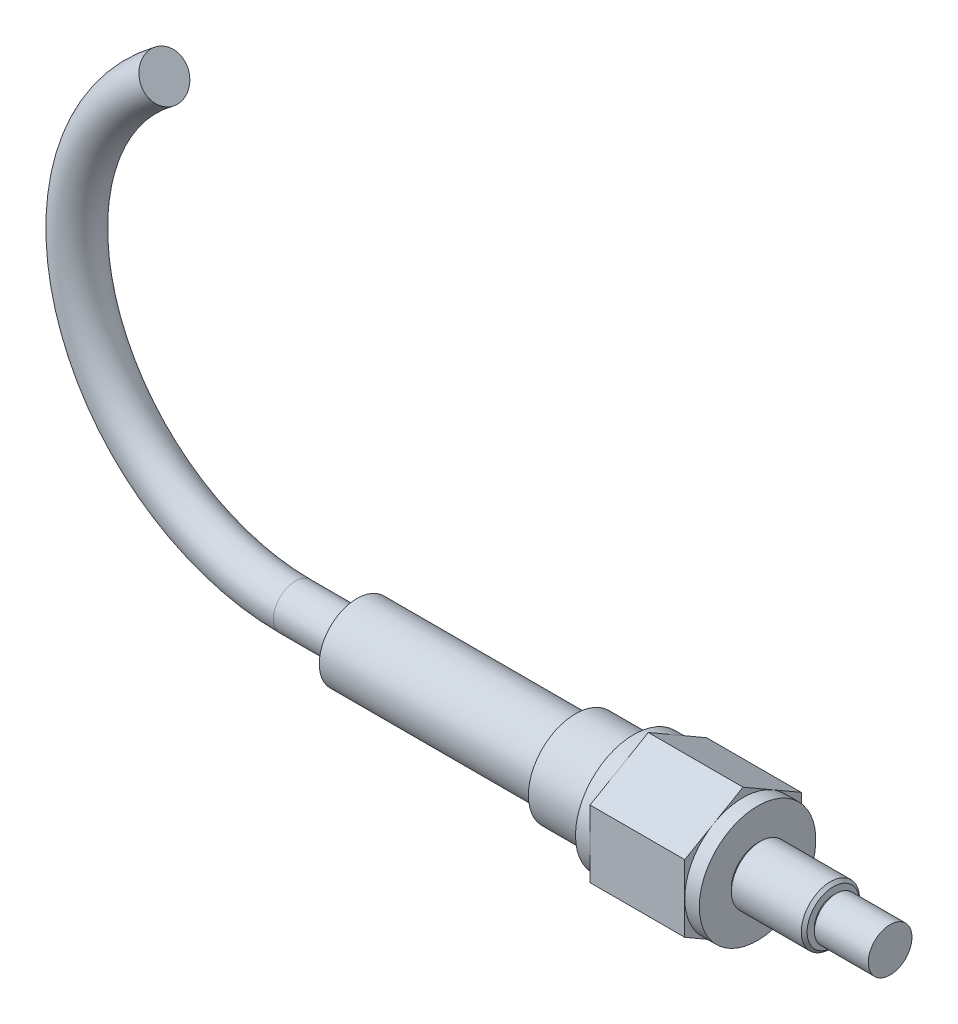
SolidWorks part; units mm, degrees
ref_plane "Front Plane" through (0, 0, 0) normal (0, 0, 1) x (1, 0, 0)
ref_plane "Top Plane" through (0, 0, 0) normal (0, 1, 0) x (1, 0, 0)
ref_plane "Right Plane" through (0, 0, 0) normal (1, 0, 0) x (0, 0, -1)
sketch "Sketch1" plane through (0, 0, 0) normal (0, 0, 1) x (1, 0, 0)
  line L0 (0, 0) -> (21.5625, 0) construction
  line L1 (0, 0) -> (0, 1.5)
  line L2 (0, 1.5) -> (-3.7, 1.5)
  line L3 (-3.7, 1.5) -> (-3.7, 1.3)
  line L4 (-3.7, 1.3) -> (-3.9, 1.3)
  line L5 (-3.9, 1.3) -> (-3.9, 1.8)
  line L6 (-3.9, 1.8) -> (-4.1, 2)
  line L7 (-4.1, 2) -> (-8.9, 2)
  line L8 (-8.9, 2) -> (-9.1, 1.8)
  line L9 (-9.1, 1.8) -> (-9.1, 4)
  line L10 (-9.1, 4) -> (-10.1, 4)
  line L11 (-10.1, 4) -> (-10.1, 0)
  line L12 (-10.1, 0) -> (0, 0)
  line L13 (-3.9, 1.8) -> (-9.1, 1.8) construction
  line L14 (-16.6, 0) -> (-16.6, 4)
  line L15 (-16.6, 4) -> (-17.6, 4)
  line L16 (-17.6, 4) -> (-17.6, 3.2345)
  line L17 (-17.6, 3.2345) -> (-21.6, 3.2345)
  line L18 (-21.6, 3.2345) -> (-21.6, 2.5903)
  line L19 (-21.6, 2.5903) -> (-36.6, 2.5903)
  line L20 (-36.6, 2.5903) -> (-36.6, 0)
  line L21 (-36.6, 0) -> (-16.6, 0)
  dimension "D1" = 3
  dimension "D2" = 0.2
  dimension "D3" = 0.2
  dimension "D4" = 3.9
  dimension "D5" = 45
  dimension "D6" = 4
  dimension "D7" = 0.2
  dimension "D8" = 1
  dimension "D9" = 10.1
  dimension "D10" = 8
  dimension "D11" = 1
  dimension "D12" = 6.5
  dimension "D13" = 20
  dimension "D14" = 4
revolve "Revolve1" add sketch "Sketch1" angle 360 about L0
sketch "Sketch2" plane through (-10.1, 0, 0) normal (-1, 0, 0) x (0, 0, 1)
  line L0 (0, 0) -> (0, 4.6188) construction
  line L1 (0, 4.6188) -> (-4, 2.3094)
  line L2 (-4, 2.3094) -> (-4, -2.3094)
  line L3 (-4, -2.3094) -> (0, -4.6188)
  line L4 (0, -4.6188) -> (4, -2.3094)
  line L5 (4, -2.3094) -> (4, 2.3094)
  line L6 (4, 2.3094) -> (0, 4.6188)
  circle A0 centre (0, 0) radius 4 construction
  circle A1 centre (0, 0) radius 4 construction
extrude "Boss-Extrude1" add sketch "Sketch2" along normal up to surface (6.5 mm away)
sketch "Sketch3" plane through (-36.6, 0, 0) normal (-1, 0, 0) x (0, 0, 1)
  circle A0 centre (0, 0) radius 1.5
  dimension "D1" = 3
sketch "Sketch4" plane through (0, 0, 0) normal (0, 0, 1) x (1, 0, 0)
  line L0 (-36.6, 0) -> (-40.8381, 0)
  line L1 (-36.6, 1.5) -> (-36.6, -1.5) construction
  arc A0 (-49.8227, 27.0116) -> (-40.8381, 0) centre (-40.8381, 15) ccw
  dimension "D1" = 15
sweep "Sweep1" add profiles "Sketch3" path "Sketch4"
